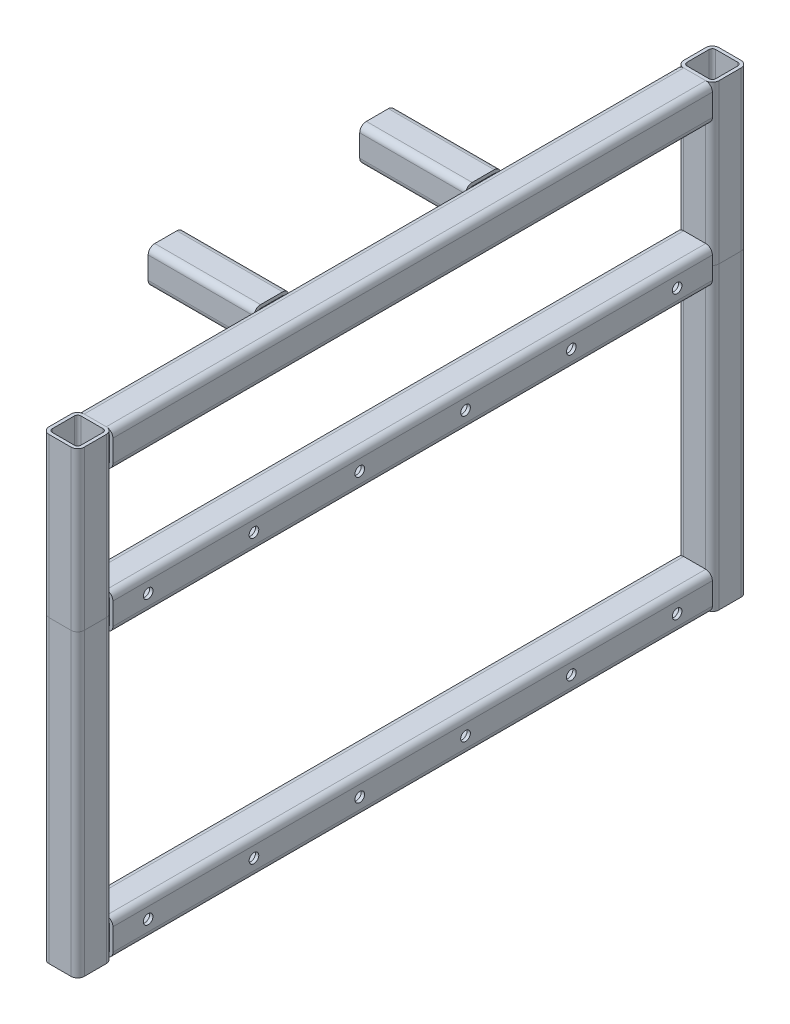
SolidWorks part; units mm, degrees
ref_plane "Front" through (0, 0, 0) normal (0, 0, 1) x (1, 0, 0)
ref_plane "Top" through (0, 0, 0) normal (0, 1, 0) x (1, 0, 0)
ref_plane "Right" through (0, 0, 0) normal (1, 0, 0) x (0, 0, -1)
sketch "Sketch2" plane through (0, 0, 0) normal (1, 0, 0) x (0, 0, -1)
  line L0 (-457.2, -203.2) -> (-457.2, -609.6)
  line L1 (-457.2, 0) -> (457.2, 0)
  line L2 (-457.2, 0) -> (-457.2, -203.2)
  line L3 (-457.2, -203.2) -> (457.2, -203.2)
  line L4 (457.2, 0) -> (457.2, -203.2)
  line L5 (-457.2, -609.6) -> (457.2, -609.6)
  line L6 (457.2, -609.6) -> (457.2, -203.2)
  point P4 (0, 0)
  dimension "D1" = 914.4
  dimension "D2" = 203.2
  dimension "D3" = 406.4
sketch "Sketch3" plane through (0, 0, 0) normal (0, 1, 0) x (1, 0, 0)
  line L0 (0, 152.4) -> (-177.8, 152.4)
  line L1 (0, -457.2) -> (0, 457.2) construction
  line L2 (0, -152.4) -> (-177.8, -152.4)
  line L3 (0, 152.4) -> (0, -152.4) construction
  point P6 (-76.2, 141.3122)
  point P7 (0, 0)
  dimension "D1" = 304.8
  dimension "D2" = 177.8
other "Tube square TS2X2X0.1875(1)"
ref_plane "Plane1" through (0, 0, 457.2) normal (0, -1, 0) x (0, 0, -1)
sketch "Sketch1" plane through (0, 0, 457.2) normal (0, -1, 0) x (0, 0, -1)
  line L0 (-15.875, -20.6375) -> (15.875, -20.6375)
  line L1 (-20.6375, -15.875) -> (-20.6375, 15.875)
  line L2 (15.875, 20.6375) -> (-15.875, 20.6375)
  line L3 (20.6375, 15.875) -> (20.6375, -15.875)
  line L4 (-15.875, -25.4) -> (15.875, -25.4)
  line L5 (-25.4, -15.875) -> (-25.4, 15.875)
  line L6 (15.875, 25.4) -> (-15.875, 25.4)
  line L7 (25.4, 15.875) -> (25.4, -15.875)
  line L8 (-25.4, 0) -> (-20.6375, 0) construction
  line L9 (-20.6375, 0) -> (20.6375, 0) construction
  line L10 (20.6375, 0) -> (25.4, 0) construction
  line L11 (0, 25.4) -> (0, 20.6375) construction
  line L12 (0, 20.6375) -> (0, -20.6375) construction
  line L13 (0, -20.6375) -> (0, -25.4) construction
  arc A0 (25.4, 15.875) -> (15.875, 25.4) centre (15.875, 15.875) ccw
  arc A1 (15.875, -25.4) -> (25.4, -15.875) centre (15.875, -15.875) ccw
  arc A2 (-25.4, -15.875) -> (-15.875, -25.4) centre (-15.875, -15.875) ccw
  arc A3 (-15.875, 25.4) -> (-25.4, 15.875) centre (-15.875, 15.875) ccw
  arc A4 (-15.875, 20.6375) -> (-20.6375, 15.875) centre (-15.875, 15.875) ccw
  arc A5 (20.6375, 15.875) -> (15.875, 20.6375) centre (15.875, 15.875) ccw
  arc A6 (15.875, -20.6375) -> (20.6375, -15.875) centre (15.875, -15.875) ccw
  arc A7 (-20.6375, -15.875) -> (-15.875, -20.6375) centre (-15.875, -15.875) ccw
  point P6 (-25.4, -25.4)
  point P33 (-25.4, 25.4)
  point P35 (25.4, 25.4)
  point P36 (25.4, -25.4)
  point P37 (0, 0)
  point P38 (0, 0)
  point P39 (0, 0)
  point P40 (0, 0)
  point P41 (0, 0)
  point P42 (0, 0)
  dimension "D1" = 9.525
  dimension "Thickness" = 4.7625
  dimension "V_leg" = 50.8
  dimension "H_leg" = 50.8
hole_wizard "1/2 Clearance Hole1" positions "Sketch6" profile "Sketch7" hole size "1/2" standard "ANSI Inch"
sketch "Sketch6" plane through (25.4, 0, 0) normal (1, 0, 0) x (0, 0, -1)
  line L0 (-457.2, -203.2) -> (457.2, -203.2) construction
  line L1 (-457.2, -609.6) -> (457.2, -609.6) construction
  line L8 (-76.2, -203.2) -> (76.2, -203.2) construction
  point P0 (-381, -203.2)
  point P4 (-228.6, -203.2)
  point P6 (-76.2, -203.2)
  point P8 (76.2, -203.2)
  point P10 (228.6, -203.2)
  point P12 (381, -203.2)
  point P14 (-381, -609.6)
  point P18 (-228.6, -609.6)
  point P20 (-76.2, -609.6)
  point P22 (76.2, -609.6)
  point P24 (228.6, -609.6)
  point P26 (381, -609.6)
  point P43 (43.3173, -152.4)
  point P44 (0, -203.2)
  point P46 (0, 0)
  point P47 (0, 0)
  point P48 (0, 0)
  point P49 (0, 0)
  point P50 (0, 0)
  point P51 (0, 0)
  point P52 (0, 0)
  point P53 (0, 0)
  point P58 (62.0702, -152.4)
  dimension "D1" = 152.4
  dimension "D2" = 152.4
  dimension "D3" = 152.4
  dimension "D4" = 152.4
  dimension "D5" = 152.4
sketch "Sketch7" plane through (25.4, -203.2, 381) normal (0, 1, 0) x (0, 0, -1)
  line L0 (0, 0) -> (0, 203.2)
  line L1 (0, 203.2) -> (6.9456, 203.2)
  line L2 (6.9456, 203.2) -> (6.9456, 0)
  line L5 (6.9456, 0) -> (0, 0)
  line L11 (0, -6.35) -> (0, 107.95) construction
  dimension "Thru Hole Dia." = 13.8913
  dimension "Thru Hole Depth" = 203.2
